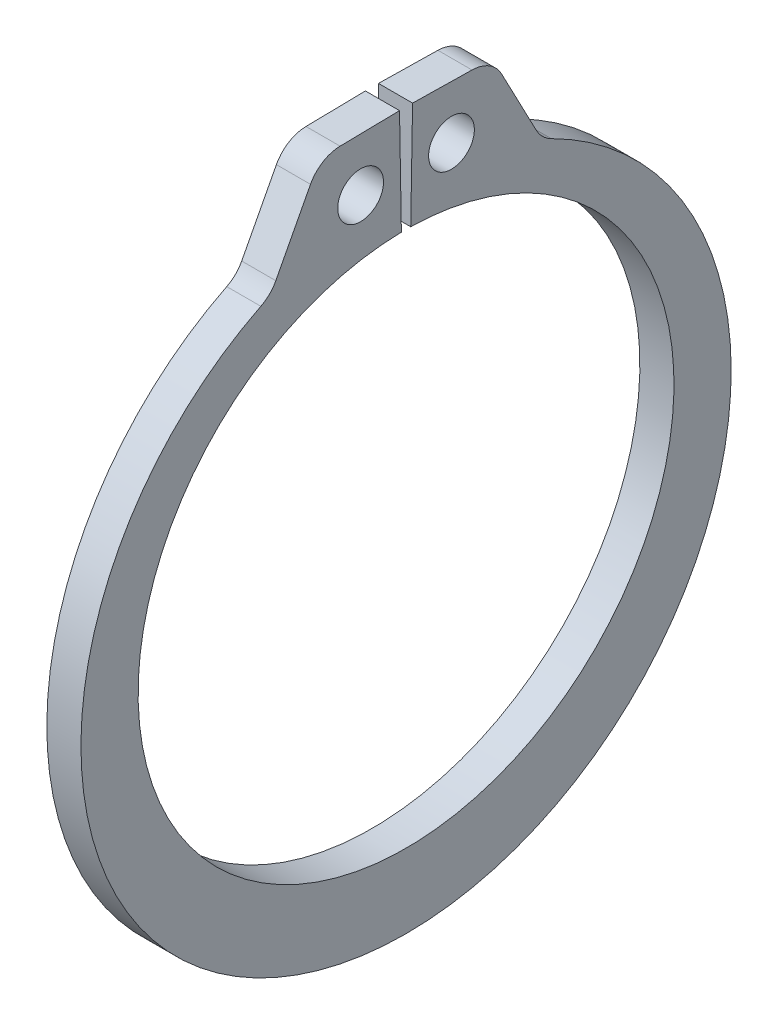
SolidWorks part; units mm, degrees
ref_plane "Front" through (0, 0, 0) normal (0, 0, 1) x (1, 0, 0)
ref_plane "Top" through (0, 0, 0) normal (0, 1, 0) x (1, 0, 0)
ref_plane "Right" through (0, 0, 0) normal (1, 0, 0) x (0, 0, -1)
sketch "Sketch1" plane through (0, 0, 0) normal (1, 0, 0) x (0, 0, -1)
  line L0 (0, 0) -> (0, 6.985) construction
  line L1 (-0.1219, 6.9839) -> (-0.1702, 9.7521)
  line L2 (0.1702, 9.7521) -> (2.2464, 9.7159)
  line L3 (2.2464, 9.7159) -> (3.5321, 7.264)
  line L4 (0.1219, 6.9839) -> (0.1702, 9.7521)
  line L5 (-0.1702, 9.7521) -> (-2.2464, 9.7159)
  line L6 (-2.2464, 9.7159) -> (-3.5321, 7.264)
  line L7 (-3.5321, 7.264) -> (-3.0545, 6.2817) construction
  line L8 (3.5321, 7.264) -> (3.0545, 6.2817) construction
  line L9 (0, -6.985) -> (0, -8.9154) construction
  line L10 (-2.2464, 9.7159) -> (-0.1219, 6.9839) construction
  line L11 (0, 6.985) -> (0, 9.7536) construction
  line L12 (-6.985, 0) -> (6.985, 0) construction
  circle A0 centre (0, 0) radius 6.985 construction
  arc A1 (-0.1219, 6.9839) -> (0.1219, 6.9839) centre (0, 0) ccw
  circle A3 centre (0, 0) radius 10.7315 construction
  circle A4 centre (-1.1841, 8.3499) radius 0.5969
  circle A5 centre (1.1841, 8.3499) radius 0.5969
  arc A6 (-3.5321, 7.264) -> (3.5321, 7.264) centre (0, -0.4402) ccw
  point P0 (0, -8.9154)
extrude "Extrude1" add sketch "Sketch1" along normal mid plane 0.889
fillet "Fillet1" radius 0.889 4 edges at (0, 7.264, 3.5321) (0, 7.264, -3.5321) (0, 9.7159, 2.2464) (0, 9.7159, -2.2464)
sketch "Sketch2" plane through (0, 0, 0) normal (0, 0, 1) x (1, 0, 0)
  line L0 (-4.9403, 0) -> (12.8397, 0)
  line L1 (12.8397, 0) -> (12.8397, -7.5438)
  line L2 (-4.9403, 0) -> (-4.9403, -7.0993)
  line L3 (12.8397, -7.5438) -> (0.4953, -7.5438)
  line L4 (0.4953, -7.5438) -> (0.4953, -7.0993)
  line L5 (0.4953, -7.0993) -> (-0.4953, -7.0993)
  line L6 (-0.4953, -7.0993) -> (-0.4953, -7.5438)
  line L7 (-0.4953, -7.5438) -> (-4.9403, -7.5438) construction
  line L8 (-4.9403, -7.5438) -> (-4.9403, 0) construction
  line L9 (12.8397, 0) -> (76.391, 0) construction
  line L10 (-4.9403, -7.0993) -> (-4.4958, -7.5438)
  line L11 (-4.4958, -7.5438) -> (-0.4953, -7.5438)
  point P10 (0, -7.0993)
revolve "Revolve1" [suppressed] add sketch "Sketch2" angle 360 about L9
delete or keep bodies "Body-Delete1" [suppressed] type delete bodies bodies 122
equation "\"D2@Sketch2\" = \"D1@Extrude1\"*20"
equation "\"D3@Sketch2\" = \"D2@Sketch2\"/4"
equation "\"D2@Sketch1\" = \"H@Sketch1\"*.75"
equation "\"D1@Fillet1\" = \"D1@Extrude1\""
